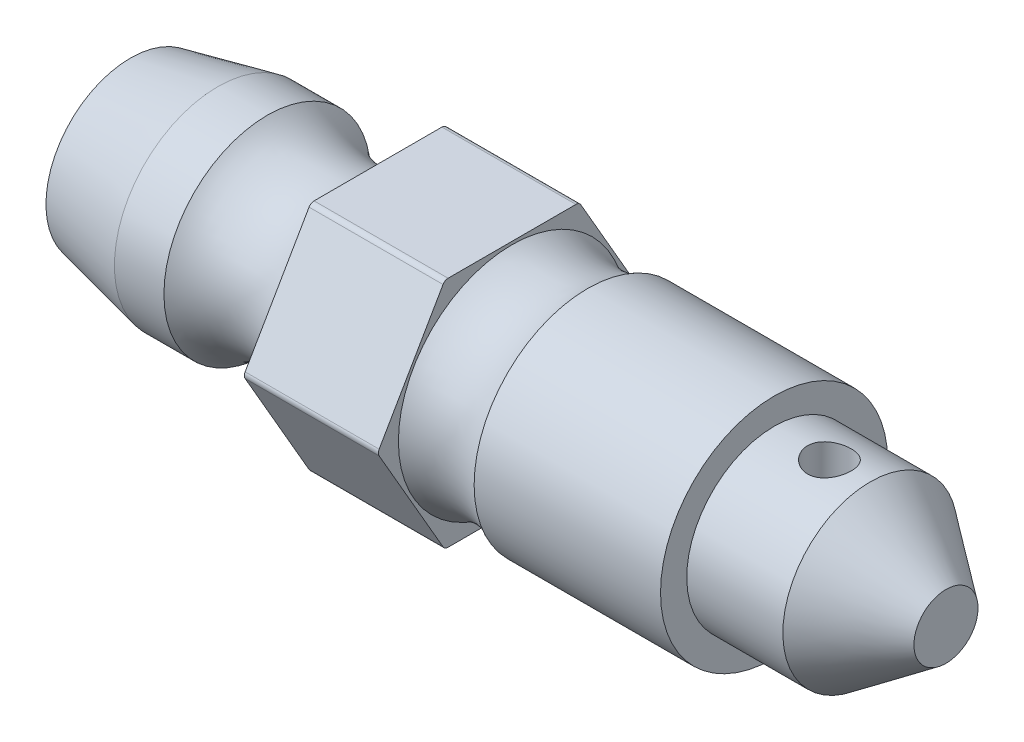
SolidWorks part; units mm, degrees
ref_plane "正面" through (0, 0, 0) normal (0, 0, 1) x (1, 0, 0)
ref_plane "平面" through (0, 0, 0) normal (0, 1, 0) x (1, 0, 0)
ref_plane "右側面" through (0, 0, 0) normal (1, 0, 0) x (0, 0, -1)
sketch "ｽｹｯﾁ1" plane through (0, 0, 0) normal (0, 0, 1) x (1, 0, 0)
  line L0 (0, 0) -> (0, 2.9)
  line L1 (0, 2.9) -> (3, 3.55)
  line L2 (3, 3.55) -> (8.5, 3.55)
  line L3 (8.5, 3.55) -> (8.5, 6.5)
  line L4 (8.5, 6.5) -> (13.1, 6.5)
  line L5 (13.1, 6.5) -> (13.1, 3.9)
  line L6 (13.1, 3.9) -> (22.1, 3.9)
  line L7 (22.1, 3.9) -> (22.1, 3)
  line L8 (22.1, 3) -> (25.4, 3)
  line L9 (25.4, 3) -> (28, 1.1)
  line L10 (28, 1.1) -> (28, 0)
  line L11 (28, 0) -> (0, 0)
  point P14 (28, 0.55)
  dimension "D1" = 3.55
  dimension "D2" = 8.5
  dimension "D3" = 3
  dimension "D4" = 2.9
  dimension "D5" = 4.6
  dimension "D6" = 6.5
  dimension "D7" = 3.9
  dimension "D8" = 9
  dimension "D9" = 3
  dimension "D10" = 1.1
  dimension "D11" = 28
  dimension "D12" = 2.6
revolve "回転1" add sketch "ｽｹｯﾁ1" angle 360 about L11
sketch "ｽｹｯﾁ2" plane through (0, 0, 0) normal (0, 1, 0) x (1, 0, 0)
  line L3 (0, 0) -> (30.0984, 0) construction
  line L6 (13.1, -6.5) -> (13.1, 6.5) construction
  line L7 (6.6, 5.5817) -> (6.6, 0) construction
  line L8 (6.6, 2.8) -> (4.7586, 2.8) construction
  line L9 (4.7, 3.55) -> (4.7, 6.5)
  line L10 (4.7, 6.5) -> (8.5, 6.5)
  line L11 (8.5, 6.5) -> (8.5, 3.55)
  line L12 (8.5, 6.5) -> (8.5, -6.5) construction
  line L13 (8.5, 3.55) -> (3, 3.55) construction
  line L14 (8.5, 3.55) -> (3, 3.55) construction
  line L16 (13.1, 6.5) -> (8.5, 6.5) construction
  line L18 (14.4, 3.55) -> (17.1865, 3.55) construction
  line L19 (13.1, 3.9) -> (13.1, 6.5)
  line L20 (13.1, 6.5) -> (15.7, 6.5)
  line L21 (15.7, 6.5) -> (15.7, 3.9)
  line L22 (22.1, 3.9) -> (13.1, 3.9) construction
  line L23 (14.4, 6.5) -> (14.4, 6.1393) construction
  line L24 (13.1, 6.5) -> (8.5, 6.5) construction
  arc A0 (4.7, 3.55) -> (8.5, 3.55) centre (6.6, 5.5817) ccw
  arc A1 (13.1, 3.9) -> (15.7, 3.9) centre (14.4, 6.1393) ccw
  dimension "D1" = 3.8
  dimension "D2" = 2.6
  dimension "D3" = 2.8
  dimension "D4" = 3.55
revolve "ｶｯﾄ - 回転1" cut sketch "ｽｹｯﾁ2" angle 360 about L3
hole_wizard "Ø3.0 (3) 直径の穴1" positions "ｽｹｯﾁ3" profile "ｽｹｯﾁ4" hole size "Ø3.0" standard "JIS"
sketch "ｽｹｯﾁ3" plane through (0, 0, 0) normal (-1, 0, 0) x (0, 0, 1)
  point P0 (0, 0)
sketch "ｽｹｯﾁ4" plane through (0, 0, 0) normal (0, 1, 0) x (0, 0, 1)
  line L0 (0, 0) -> (0, 27.4013)
  line L1 (0, 27.4013) -> (1.5, 26.5)
  line L2 (1.5, 26.5) -> (1.5, 0)
  line L5 (1.5, 0) -> (0, 0)
  line L10 (0, 27.4013) -> (-1.5, 26.5) construction
  line L11 (0, -6.35) -> (0, 107.95) construction
  dimension "穴の直径" = 3
  dimension "穴の深さ" = 26.5
  dimension "ﾄﾞﾘﾙ角度" = 118
hole_wizard "Ø1.5 (1.5) 直径の穴1" positions "3Dｽｹｯﾁ1" profile "ｽｹｯﾁ7" hole size "Ø1.5" standard "JIS"
sketch3d "3Dｽｹｯﾁ1"
  line L0 (28, 0, 0) -> (28, 3, 0) construction
  line L1 (25.4, 0, 0) -> (28, 0, 0) construction
  line L2 (28, 3, 0) -> (21.4338, 3, 0) construction
  point P0 (24, 3, 0)
  dimension "D1" = 4
sketch "ｽｹｯﾁ7" plane through (24, 3, 0) normal (1, 0, 0) x (0, 0, 1)
  line L0 (0, 0) -> (0, 9.5)
  line L1 (0, 9.5) -> (0.75, 9.5)
  line L2 (0.75, 9.5) -> (0.75, 0)
  line L5 (0.75, 0) -> (0, 0)
  line L11 (0, -6.35) -> (0, 107.95) construction
  dimension "通し穴の直径" = 1.5
  dimension "通し穴の深さ" = 9.5
sketch "ｽｹｯﾁ8" plane through (8.5, 0, 0) normal (-1, 0, 0) x (0, 0, 1)
  line L1 (4.6188, 0) -> (2.3094, 4)
  line L2 (2.3094, 4) -> (-2.3094, 4)
  line L3 (-2.3094, 4) -> (-4.6188, 0)
  line L4 (-4.6188, 0) -> (-2.3094, -4)
  line L5 (-2.3094, -4) -> (2.3094, -4)
  line L6 (2.3094, -4) -> (4.6188, 0)
  circle A0 centre (0, 0) radius 4 construction
  dimension "D1" = 8
extrude "ｶｯﾄ - 押し出し1" cut sketch "ｽｹｯﾁ8" against normal through all flip side to cut
fillet "ﾌｨﾚｯﾄ1" radius 0.2 6 edges at (10.8, 4, -2.3094) (10.8, 4, 2.3094) (10.8, 0, 4.6188) (10.8, -4, 2.3094) (10.8, -4, -2.3094) (10.8, 0, -4.6188)
